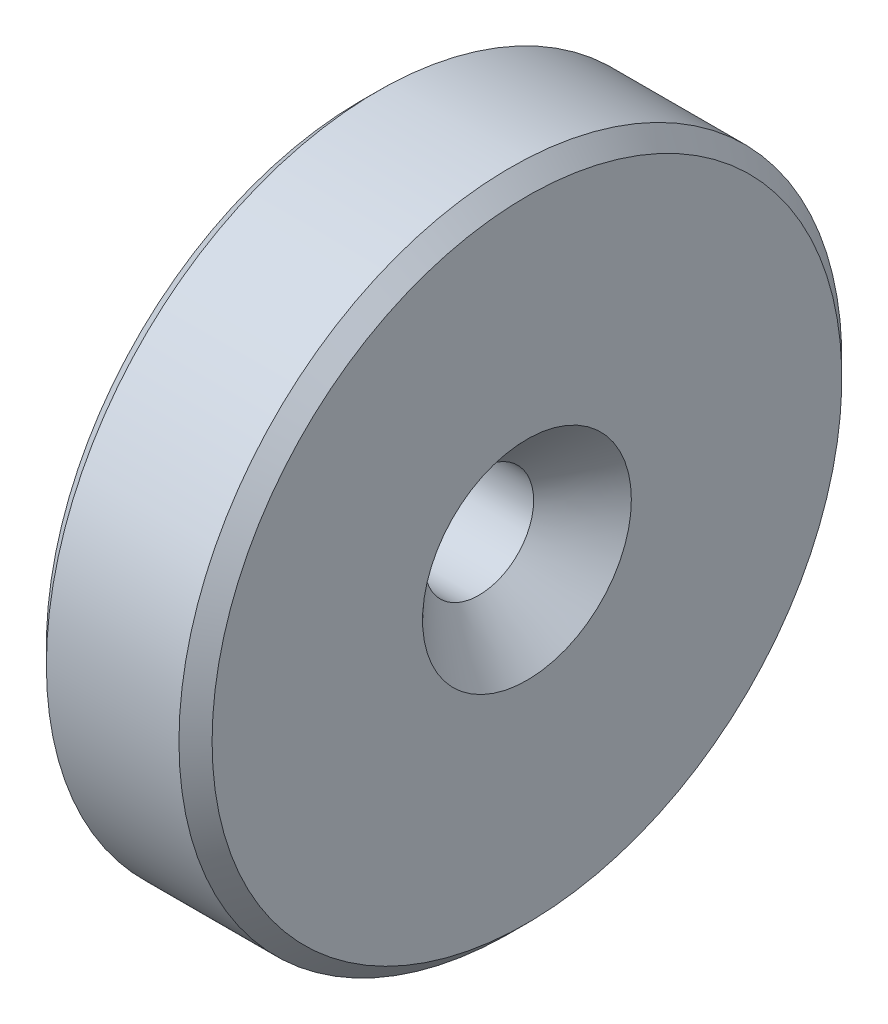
SolidWorks part; units mm, degrees
ref_plane "Plan1" through (0, 0, 0) normal (0, 0, 1) x (1, 0, 0)
ref_plane "Plan2" through (0, 0, 0) normal (0, 1, 0) x (1, 0, 0)
ref_plane "Plan3" through (0, 0, 0) normal (1, 0, 0) x (0, 0, -1)
sketch "Esquisse1" plane through (0, 0, 0) normal (0, 0, 1) x (1, 0, 0)
  line L0 (0, 0) -> (20, 0) construction
  line L2 (0, 0) -> (10, 0)
  line L3 (0, 0) -> (0, 20)
  line L4 (0, 20) -> (10, 20)
  line L5 (10, 0) -> (10, 20)
  dimension "D1" = 10
  dimension "D2" = 20
revolve "Base-Révolution" add sketch "Esquisse1" angle 360 about L0
chamfer "Chanfrein1" distance 1 angle 45 2 edges at (10, 0, 20) (0, 0, 20)
hole_wizard "Perçage1" positions "Esquisse3" profile "Esquisse2" countersink size "M6" standard "ISO"
sketch "Esquisse3" plane through (10, 0, 0) normal (1, 0, 0) x (0, 0, -1)
  circle A0 centre (0, 0) radius 20 construction
  point P0 (0, 0)
sketch "Esquisse2" plane through (10, 0, 0) normal (0, 1, 0) x (0, 0, -1)
  line L0 (0, 0) -> (0, 10)
  line L1 (0, 10) -> (3.3, 10)
  line L2 (3.3, 10) -> (3.3, 2.8971)
  line L3 (3.3, 2.8971) -> (6.3, 0)
  line L5 (6.3, 0) -> (0, 0)
  line L6 (-3.3, 2.8971) -> (-6.3, 0) construction
  line L11 (0, -6.35) -> (0, 107.95) construction
  dimension "Diamètre du perçage jusqu'au prochain" = 6.6
  dimension "Profondeur du perçage jusqu'au prochain" = 10
  dimension "Diamètre du fraisage entrant" = 12.6
  dimension "Angle du fraisage entrant" = 92
sketch "Esquisse5" plane through (0, 0, 0) normal (0, 1, 0) x (1, 0, 0)
  line L0 (0, 0) -> (10, 0) construction
  line L2 (-2, 0.125) -> (0.1, 0.125)
  line L3 (-2, 0.125) -> (-2, -0.125)
  line L4 (-2, -0.125) -> (0.1, -0.125)
  line L5 (0.1, 0.125) -> (0.1, -0.125)
  dimension "D1" = 2
  dimension "D2" = 0.25
  dimension "D3" = 2.1
extrude "Enlèv. mat.-Extru.1" cut sketch "Esquisse5" against normal mid plane 40
sketch "Esq_WRNL_Compact001" plane through (0, 0, 0) normal (0, 0, 1) x (1, 0, 0)
  line L0 (-1, -21) -> (-1, 21)
  line L1 (11, -21) -> (11, 21)
  line L2 (-1, -21) -> (11, -21)
  line L3 (-1, 21) -> (11, 21)
